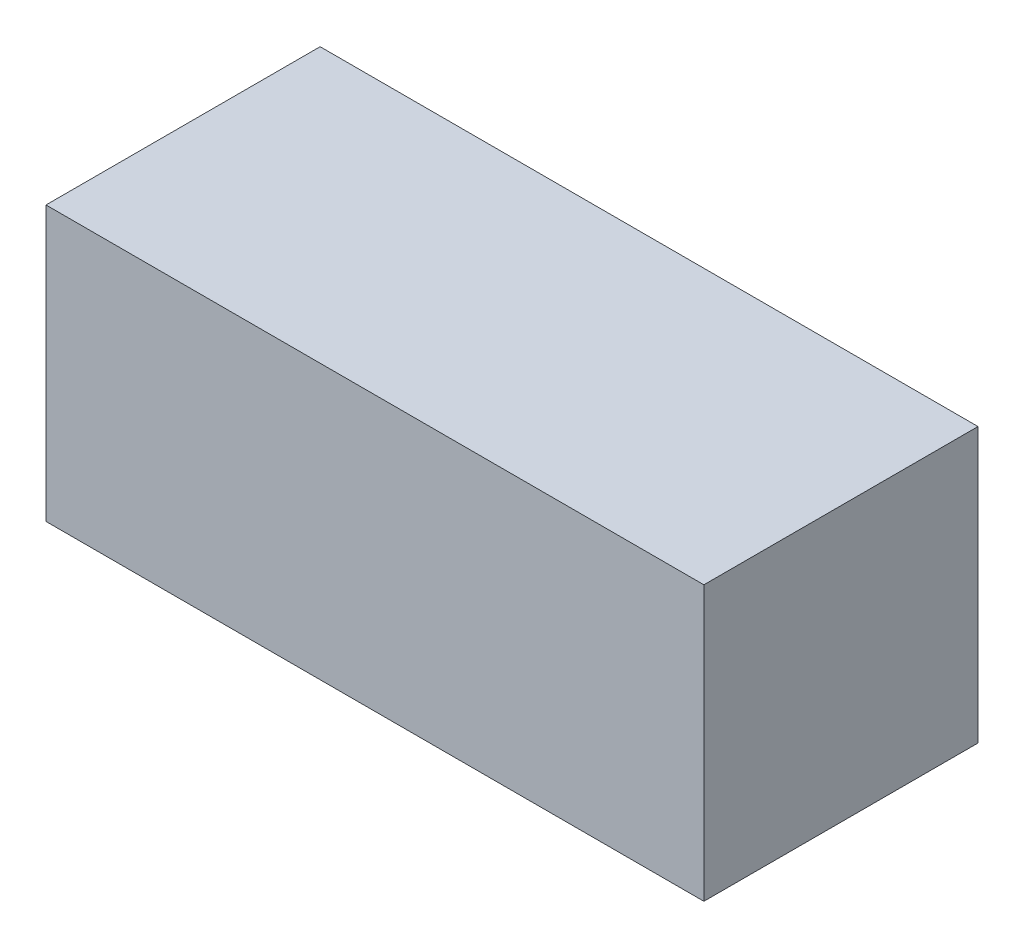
SolidWorks part; units mm, degrees
ref_plane "Front Plane" through (0, 0, 0) normal (0, 0, 1) x (1, 0, 0)
ref_plane "Top Plane" through (0, 0, 0) normal (0, 1, 0) x (1, 0, 0)
ref_plane "Right Plane" through (0, 0, 0) normal (1, 0, 0) x (0, 0, -1)
sketch "Sketch1" plane through (0, 0, 0) normal (0, 0, 1) x (1, 0, 0)
  line L1 (-3.5048, 1.8619) -> (1.2952, 1.8619)
  line L2 (-3.5048, 1.8619) -> (-3.5048, -0.1381)
  line L3 (-3.5048, -0.1381) -> (1.2952, -0.1381)
  line L4 (1.2952, 1.8619) -> (1.2952, -0.1381)
  dimension "D1" = 4.8
  dimension "D2" = 2
extrude "Boss-Extrude1" add sketch "Sketch1" along normal blind 2
